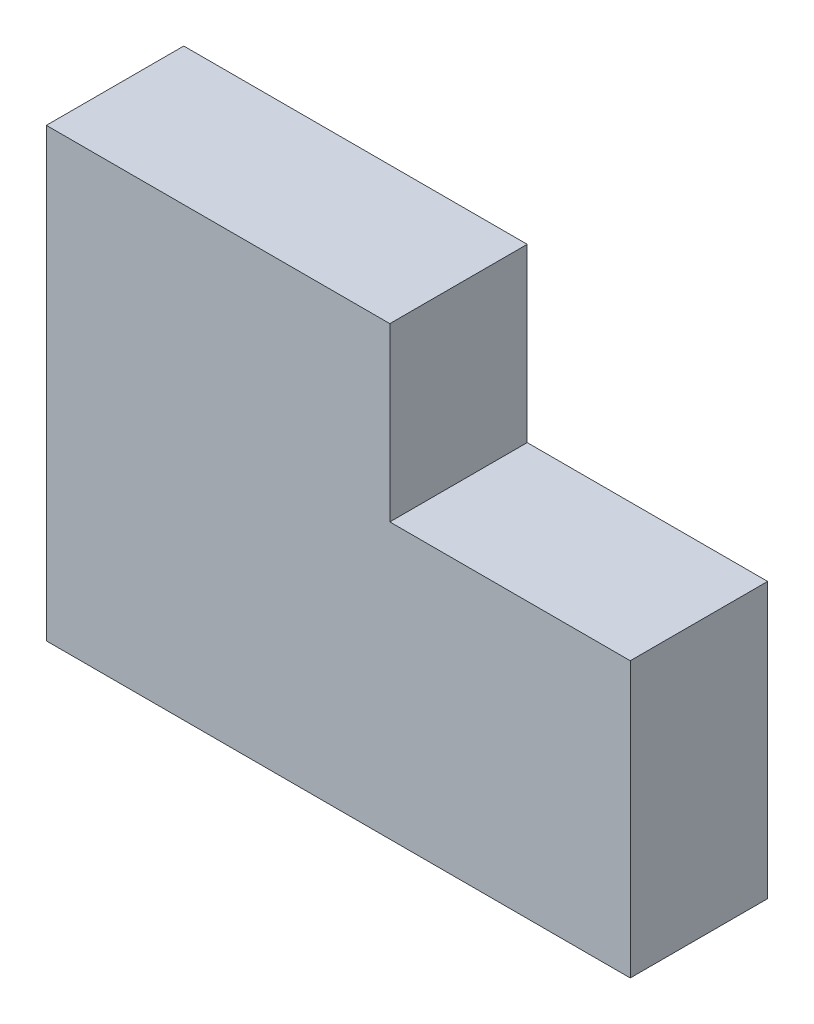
SolidWorks part; units mm, degrees
ref_plane "Front Plane" through (0, 0, 0) normal (0, 0, 1) x (1, 0, 0)
ref_plane "Top Plane" through (0, 0, 0) normal (0, 1, 0) x (1, 0, 0)
ref_plane "Right Plane" through (0, 0, 0) normal (1, 0, 0) x (0, 0, -1)
sketch "Sketch1" plane through (0, 0, 0) normal (0, 0, 1) x (1, 0, 0)
  line L0 (0, 0) -> (85, 0)
  line L1 (85, 0) -> (85, 40)
  line L2 (85, 40) -> (50, 40)
  line L3 (50, 40) -> (50, 65)
  line L4 (50, 65) -> (0, 65)
  line L5 (0, 65) -> (0, 0)
  dimension "D1" = 85
  dimension "D2" = 40
  dimension "D3" = 65
  dimension "D4" = 50
extrude "Extrude1" add sketch "Sketch1" along normal blind 20
